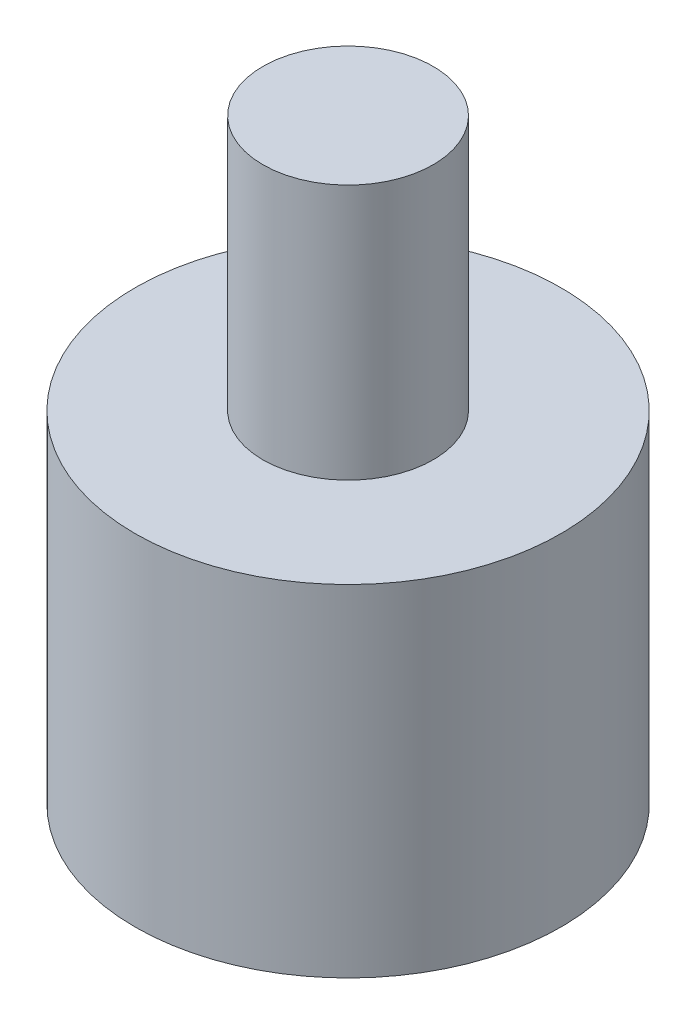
SolidWorks part; units mm, degrees
ref_plane "Front Plane" through (0, 0, 0) normal (0, 0, 1) x (1, 0, 0)
ref_plane "Top Plane" through (0, 0, 0) normal (0, 1, 0) x (1, 0, 0)
ref_plane "Right Plane" through (0, 0, 0) normal (1, 0, 0) x (0, 0, -1)
sketch "Sketch1" plane through (0, 0, 0) normal (0, 1, 0) x (1, 0, 0)
  circle A0 centre (0, 0) radius 5
  dimension "D1" = 10
extrude "Boss-Extrude1" add sketch "Sketch1" along normal blind 8
sketch "Sketch2" plane through (0, 8, 0) normal (0, 1, 0) x (1, 0, 0)
  circle A0 centre (0, 0) radius 2
  dimension "D1" = 4
extrude "Boss-Extrude2" add sketch "Sketch2" along normal blind 6
